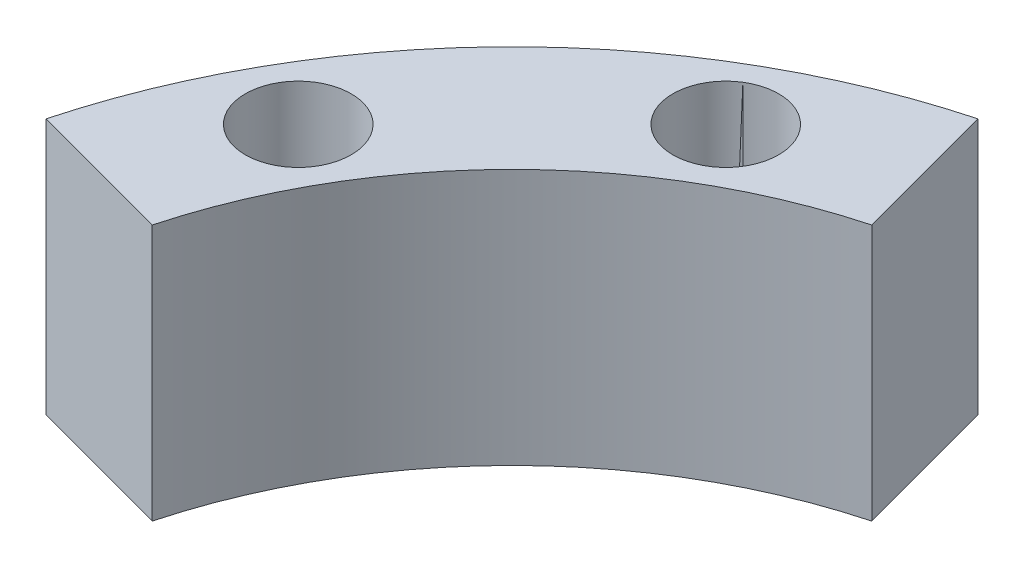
SolidWorks part; units mm, degrees
ref_plane "Front Plane" through (0, 0, 0) normal (0, 0, 1) x (1, 0, 0)
ref_plane "Top Plane" through (0, 0, 0) normal (0, 1, 0) x (1, 0, 0)
ref_plane "Right Plane" through (0, 0, 0) normal (1, 0, 0) x (0, 0, -1)
sketch "Sketch1" plane through (0, 0, 0) normal (0, 1, 0) x (1, 0, 0)
  line L0 (-39.7189, 10.6426) -> (-30.6681, 8.2175)
  line L1 (-8.2175, 30.6681) -> (-10.6426, 39.7189)
  line L2 (0, 0) -> (-49.281, 0) construction
  line L3 (0, 0) -> (-30.6681, 8.2175) construction
  line L4 (0, 0) -> (-8.2175, 30.6681) construction
  line L5 (0, 0) -> (0, 43.4721) construction
  line L6 (0, 0) -> (-22.4506, 22.4506) construction
  line L7 (-31.5548, 18.2181) -> (0, 0) construction
  line L8 (0, 0) -> (-18.2182, 31.5548) construction
  arc A0 (-30.6681, 8.2175) -> (-8.2175, 30.6681) centre (0, 0) cw
  arc A1 (-10.6426, 39.7189) -> (-39.7189, 10.6426) centre (0, 0) ccw
  arc A2 (-9.4304, 35.1948) -> (-35.1948, 9.4304) centre (0, 0) ccw construction
  circle A3 centre (-31.5548, 18.2181) radius 3.302
  circle A4 centre (-18.2182, 31.5548) radius 3.302
  dimension "D1" = 41.12
  dimension "D2" = 9.37
  dimension "D6" = 6.604
  dimension "D9" = 72.8726
  dimension "D3" = 15
  dimension "D4" = 15
  dimension "D5" = 45
  dimension "D7" = 30
  dimension "D8" = 30
extrude "Extrude1" add sketch "Sketch1" along normal blind 16
ref_plane "Plane1" through (0, 0, 0) normal (-0.7071, 0, 0.7071) x (0.7071, 0, 0.7071)
ref_plane "Plane2" through (-7.8807, 0, 7.8807) normal (-0.7071, 0, 0.7071) x (0.7071, 0, 0.7071)
sketch "Sketch2" plane through (-7.8807, 0, 7.8807) normal (-0.7071, 0, 0.7071) x (0.7071, 0, 0.7071)
  line L0 (-39.1483, 8) -> (-39.1483, 7.3735)
  line L1 (-38.3799, 6.605) -> (-41.12, 6.605)
  line L2 (-41.12, 6.605) -> (-41.12, 8)
  line L3 (-41.12, 8) -> (-39.1483, 8)
  line L4 (-41.12, 8) -> (-39.1483, 8) construction
  arc A0 (-39.1483, 7.3735) -> (-38.3799, 6.605) centre (-38.3799, 7.3735) ccw
revolve "Cut-Revolve1" cut sketch "Sketch2" angle 360 about L4
ref_plane "Plane3" through (7.8807, 0, -7.8807) normal (-0.7071, 0, 0.7071) x (0.7071, 0, 0.7071)
sketch "Sketch3" plane through (7.8807, 0, -7.8807) normal (-0.7071, 0, 0.7071) x (0.7071, 0, 0.7071)
  line L0 (-39.1483, 8) -> (-39.1483, 7.3735)
  line L1 (-38.3799, 6.605) -> (-41.12, 6.605)
  line L2 (-41.12, 6.605) -> (-41.12, 8)
  line L3 (-41.12, 8) -> (-39.1483, 8)
  line L4 (-41.12, 8) -> (-39.1483, 8) construction
  arc A0 (-39.1483, 7.3735) -> (-38.3799, 6.605) centre (-38.3799, 7.3735) ccw
revolve "Cut-Revolve2" cut sketch "Sketch3" angle 360 about L4
ref_plane "Plane4" through (0, 0, 0) normal (0.7071, 0, 0.7071) x (0.7071, 0, -0.7071)
ref_plane "Plane5" through (-29.0762, 0, -29.0762) normal (0.7071, 0, 0.7071) x (0.7071, 0, -0.7071)
sketch "Sketch4" plane through (-27.6821, 0, -27.6821) normal (0.7071, 0, 0.7071) x (0.7071, 0, -0.7071)
  line L0 (10.43, 8.4128) -> (10.43, 7.5872)
  line L1 (10.43, 7.5872) -> (11.145, 7.1744)
  line L2 (11.145, 7.1744) -> (11.86, 7.5872)
  line L3 (11.86, 7.5872) -> (11.86, 8.4128)
  line L4 (11.86, 8.4128) -> (11.145, 8.8256)
  line L5 (11.145, 8.8256) -> (10.43, 8.4128)
extrude "Cut-Extrude1" cut sketch "Sketch4" along normal blind 3
sketch "Sketch5" plane through (-27.6821, 0, -27.6821) normal (0.7071, 0, 0.7071) x (0.7071, 0, -0.7071)
  line L0 (-11.86, 8.4128) -> (-11.86, 7.5872)
  line L1 (-11.86, 7.5872) -> (-11.145, 7.1744)
  line L2 (-11.145, 7.1744) -> (-10.43, 7.5872)
  line L3 (-10.43, 7.5872) -> (-10.43, 8.4128)
  line L4 (-10.43, 8.4128) -> (-11.145, 8.8256)
  line L5 (-11.145, 8.8256) -> (-11.86, 8.4128)
extrude "Cut-Extrude2" cut sketch "Sketch5" along normal blind 3
